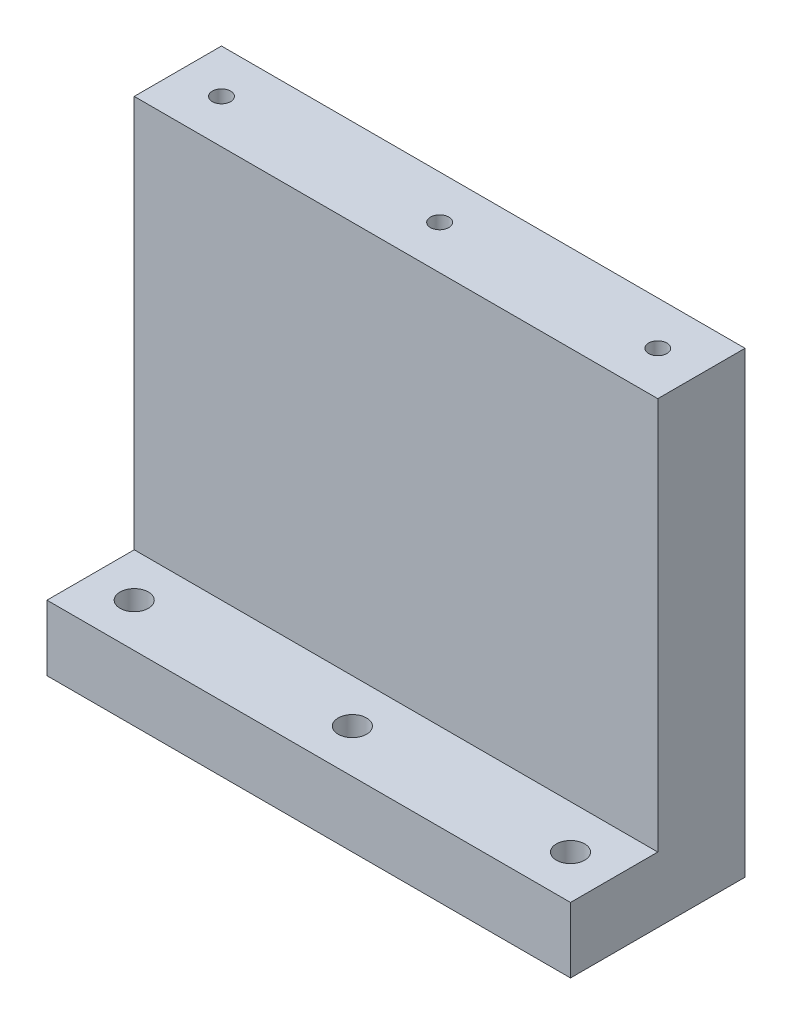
SolidWorks part; units mm, degrees
ref_plane "前视基准面" through (0, 0, 0) normal (0, 0, 1) x (1, 0, 0)
ref_plane "上视基准面" through (0, 0, 0) normal (0, 1, 0) x (1, 0, 0)
ref_plane "右视基准面" through (0, 0, 0) normal (1, 0, 0) x (0, 0, -1)
sketch "草图1" plane through (0, 0, 0) normal (0, 0, 1) x (1, 0, 0)
  line L0 (0, 105) -> (120, 105)
  line L1 (0, 0) -> (120, 0)
  line L2 (0, 0) -> (0, 105)
  line L3 (120, 0) -> (120, 105)
extrude "凸台-拉伸1" add sketch "草图1" along normal blind 40
sketch "草图2" plane through (120, 0, 0) normal (1, 0, 0) x (0, 0, -1)
  line L0 (-20, 15) -> (-20, 105)
  line L1 (0, 0) -> (0, 105)
  line L2 (-20, 105) -> (0, 105)
  line L3 (-40, 0) -> (0, 0)
  line L4 (-40, 15) -> (-20, 15)
  line L5 (-40, 0) -> (-40, 15)
extrude "切除-拉伸1" cut sketch "草图2" against normal through all flip side to cut
sketch "草图3" plane through (0, 15, 0) normal (0, 1, 0) x (1, 0, 0)
  circle A0 centre (110, -30) radius 3.25
  circle A1 centre (60, -30) radius 3.25
  circle A2 centre (10, -30) radius 3.25
extrude "切除-拉伸2" cut sketch "草图3" against normal blind 40
sketch "草图4" plane through (0, 105, 0) normal (0, 1, 0) x (1, 0, 0)
  circle A0 centre (10, -10) radius 2.1
  circle A1 centre (60, -10) radius 2.1
  circle A2 centre (110, -10) radius 2.1
extrude "切除-拉伸3" cut sketch "草图4" against normal blind 15
